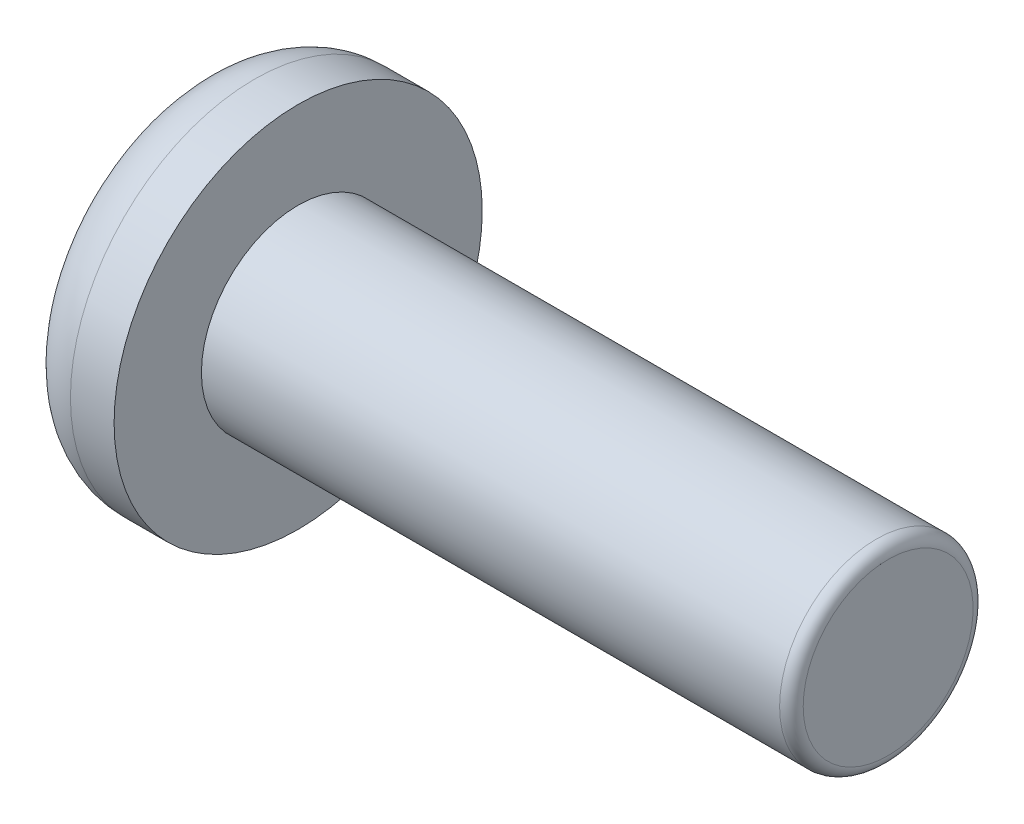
SolidWorks part; units mm, degrees
ref_plane "Plane1" through (0, 0, 0) normal (0, 0, 1) x (1, 0, 0)
ref_plane "Plane2" through (0, 0, 0) normal (0, 1, 0) x (1, 0, 0)
ref_plane "Plane3" through (0, 0, 0) normal (1, 0, 0) x (0, 0, -1)
sketch "Sketch1" plane through (0, 0, 0) normal (0, 0, 1) x (1, 0, 0)
  line L0 (0, 0) -> (144.78, 0) construction
  line L1 (0, 0) -> (0, 2.6924)
  line L2 (1.27, 3.9624) -> (2.2098, 3.9624)
  line L3 (2.2098, 3.9624) -> (2.2098, 2.0828)
  line L4 (2.2098, 2.0828) -> (14.9098, 2.0828)
  line L5 (14.9098, 2.0828) -> (14.9098, 0)
  line L6 (14.9098, 0) -> (0, 0)
  arc A0 (1.27, 3.9624) -> (0, 2.6924) centre (1.27, 2.6924) ccw
  point P10 (0, 3.9624)
  dimension "D4" = 1.27
  dimension "D1" = 3.9624
  dimension "D2" = 2.0828
  dimension "D3" = 2.2098
  dimension "D5" = 12.7
revolve "Base-Revolve" add sketch "Sketch1" angle 360 about L0
sketch "Hexagon - circumscribed1" plane through (0, 0.0125, -0.0315) normal (-1, 0, 0) x (0, 0, 1)
  line L0 (-0.6559, 1.1782) -> (0.7189, 1.1782)
  line L1 (0.7189, 1.1782) -> (1.4063, -0.0125)
  line L2 (1.4063, -0.0125) -> (0.7189, -1.2031)
  line L3 (0.7189, -1.2031) -> (-0.6559, -1.2031)
  line L4 (-0.6559, -1.2031) -> (-1.3433, -0.0125)
  line L5 (-1.3433, -0.0125) -> (-0.6559, 1.1782)
  circle A0 centre (0.0315, -0.0125) radius 1.1906 construction
  dimension "D1" = 2.3813
extrude "Cut-Extrude1" cut sketch "Hexagon - circumscribed1" against normal blind 2.54
fillet "Fillet1" radius 0.254
